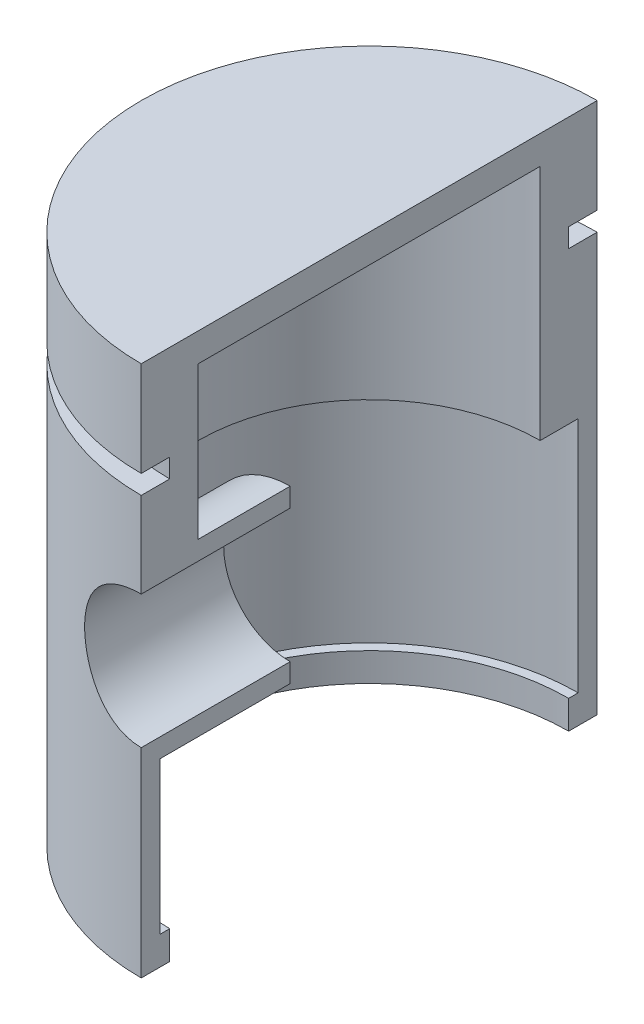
SolidWorks part; units mm, degrees
ref_plane "Front" through (0, 0, 0) normal (0, 0, 1) x (1, 0, 0)
ref_plane "Top" through (0, 0, 0) normal (0, 1, 0) x (1, 0, 0)
ref_plane "Right" through (0, 0, 0) normal (1, 0, 0) x (0, 0, -1)
sketch "Sketch1" plane through (0, 0, 0) normal (1, 0, 0) x (0, 0, -1)
  line L0 (38.1, 88.9) -> (0, 88.9)
  line L1 (0, 88.9) -> (0, 84.1375)
  line L2 (0, 84.1375) -> (28.575, 84.1375)
  line L3 (28.575, 84.1375) -> (28.575, 44.45)
  line L4 (28.575, 44.45) -> (34.925, 44.45)
  line L5 (34.925, 44.45) -> (34.925, 4.7625)
  line L6 (34.925, 4.7625) -> (33.3375, 4.7625)
  line L7 (33.3375, 4.7625) -> (33.3375, 0)
  line L8 (33.3375, 0) -> (38.1, 0)
  line L9 (38.1, 0) -> (38.1, 88.9)
  line L10 (0, 88.9) -> (0, 0) construction
  dimension "D1" = 28.575
  dimension "D2" = 33.3375
  dimension "D3" = 34.925
  dimension "D4" = 38.1
  dimension "D5" = 4.7625
  dimension "D6" = 44.45
  dimension "D7" = 84.1375
  dimension "D8" = 88.9
revolve "Main" add sketch "Sketch1" angle 180 about L10
ref_plane "CB Plane" through (0, 0, 13.208) normal (0, 0, 1) x (1, 0, 0)
sketch "Sketch5" plane through (0, 0, 13.208) normal (0, 0, 1) x (1, 0, 0)
  line L0 (0, -55.9859) -> (0, 55.9859) construction
  line L1 (-38.1, 0) -> (0, 0) construction
  line L2 (0, 0) -> (0, 88.9) construction
  line L3 (0, 30.1625) -> (0, 58.7375)
  arc A0 (0, 58.7375) -> (0, 30.1625) centre (0, 44.45) ccw
  dimension "D2" = 28.575
  dimension "D1" = 44.45
extrude "Circular Boss" add sketch "Sketch5" along normal up to next
sketch "Sketch6" plane through (0, 0, 13.208) normal (0, 0, 1) x (1, 0, 0)
  circle A0 centre (0, 44.45) radius 11.1125
  dimension "D1" = 22.225
extrude "Circular Cut" cut sketch "Sketch6" along normal through all
sketch "Sketch7" plane through (0, 7.4473, 55.2427) normal (1, 0, 0) x (0, 0, -1)
  line L0 (93.3427, 62.4027) -> (93.3427, 65.5777)
  line L1 (93.3427, 65.5777) -> (88.5802, 65.5777)
  line L2 (88.5802, 65.5777) -> (88.5802, 62.4027)
  line L3 (88.5802, 62.4027) -> (93.3427, 62.4027)
  line L4 (55.2427, 65.5777) -> (55.2427, 62.4027) construction
  line L7 (93.3427, -7.4473) -> (93.3427, 81.4527) construction
  dimension "D1" = 33.3375
  dimension "D2" = 38.1
  dimension "D3" = 3.175
  dimension "D4" = 69.85
revolve "Cut-Revolve1" cut sketch "Sketch7" angle 360 about L4
